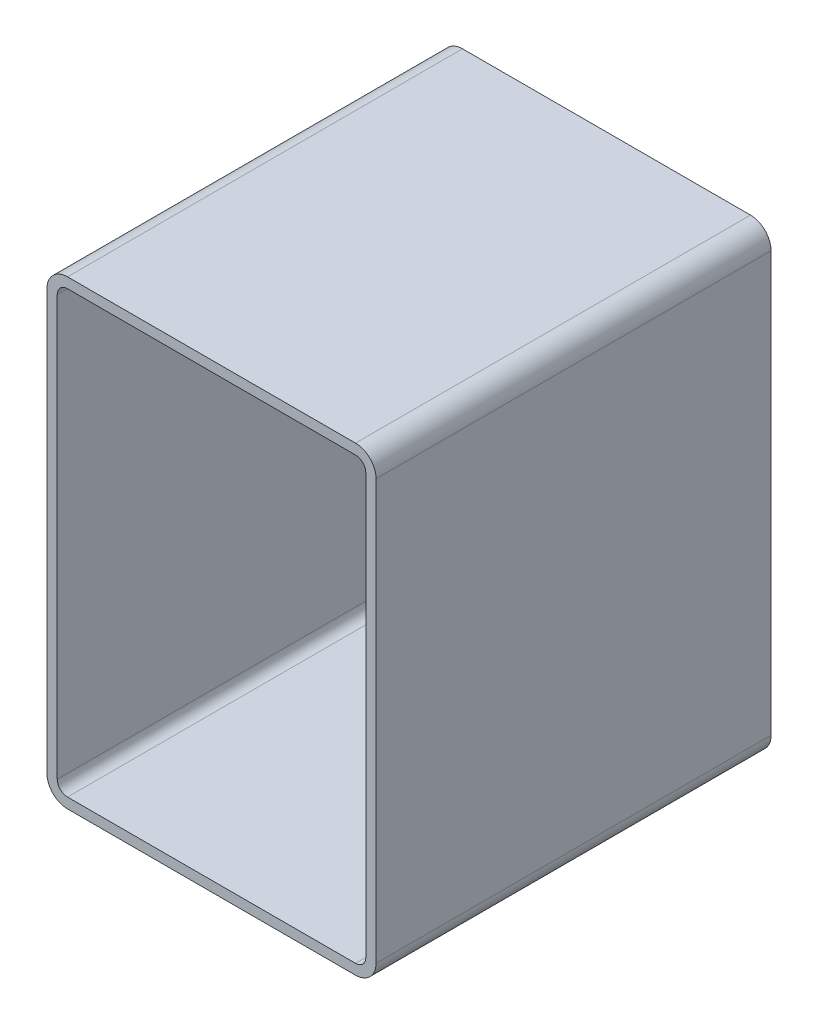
SolidWorks part; units mm, degrees
ref_plane "Front Plane" through (0, 0, 0) normal (0, 0, 1) x (1, 0, 0)
ref_plane "Top Plane" through (0, 0, 0) normal (0, 1, 0) x (1, 0, 0)
ref_plane "Right Plane" through (0, 0, 0) normal (1, 0, 0) x (0, 0, -1)
sketch "Sketch1" plane through (0, 0, 0) normal (0, 0, 1) x (1, 0, 0)
sketch_block_instance "HSS14x10x0.3125-1"
sketch_block "HSS14x10x0.3125"
extrude "Boss-Extrude1" add sketch "Sketch1" along normal blind 304.8
